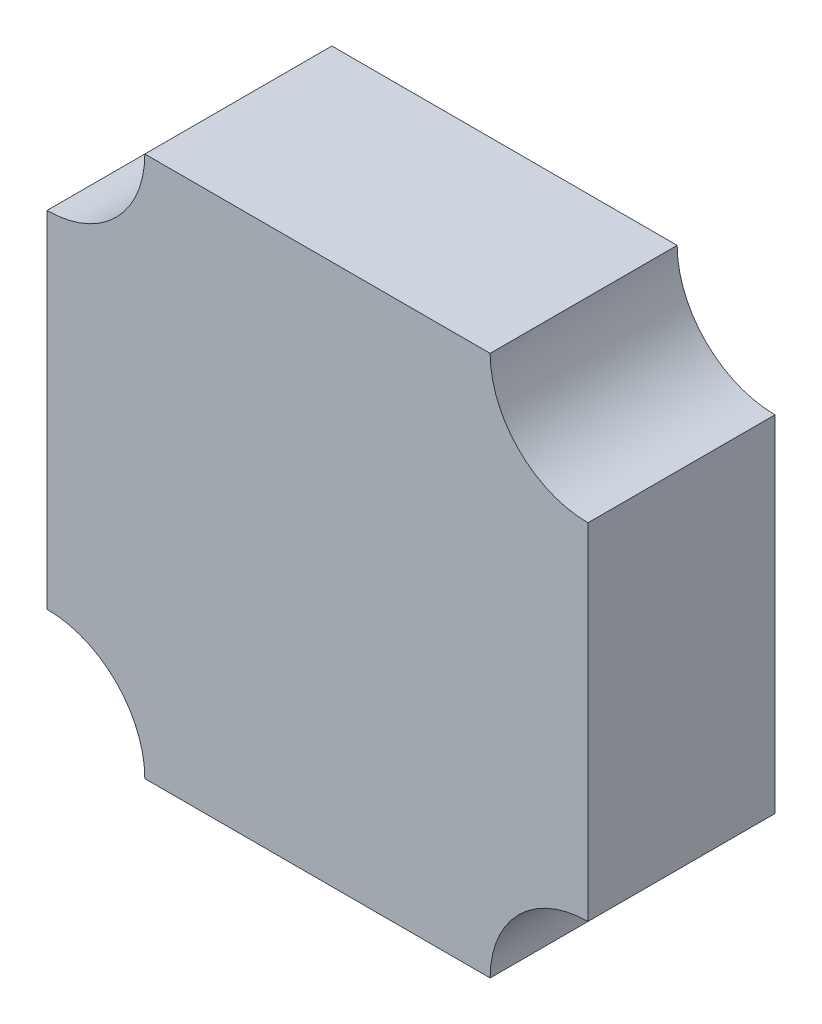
SolidWorks part; units mm, degrees
ref_plane "前视" through (0, 0, 0) normal (0, 0, 1) x (1, 0, 0)
ref_plane "上视" through (0, 0, 0) normal (0, 1, 0) x (1, 0, 0)
ref_plane "右视" through (0, 0, 0) normal (1, 0, 0) x (0, 0, -1)
sketch "草图1" plane through (0, 0, 0) normal (0, 0, 1) x (1, 0, 0)
  line L1 (18, -28.2) -> (-18, -28.2)
  line L2 (28.2, -18) -> (28.2, 18)
  line L3 (18, 28.2) -> (-18, 28.2)
  line L4 (-28.2, -18) -> (-28.2, 18)
  line L5 (28.2, -28.2) -> (-28.2, 28.2) construction
  line L6 (28.2, 28.2) -> (-28.2, -28.2) construction
  line L11 (18, -28.2) -> (-18, 28.2) construction
  line L12 (18, 28.2) -> (-18, -28.2) construction
  line L17 (28.2, -18) -> (-28.2, 18) construction
  line L18 (28.2, 18) -> (-28.2, -18) construction
  arc A0 (-28.2, 18) -> (-18, 28.2) centre (-28.2, 28.2) ccw
  arc A1 (18, 28.2) -> (28.2, 18) centre (28.2, 28.2) ccw
  arc A2 (28.2, -18) -> (18, -28.2) centre (28.2, -28.2) ccw
  arc A3 (-28.2, -18) -> (-18, -28.2) centre (-28.2, -28.2) cw
  point P0 (0, 0)
  point P6 (0, 0)
  point P11 (0, 0)
  dimension "D1" = 56.4
  dimension "D2" = 56.4
  dimension "D3" = 36
  dimension "D4" = 36
extrude "凸台-拉伸1" add sketch "草图1" along normal blind 19.5
